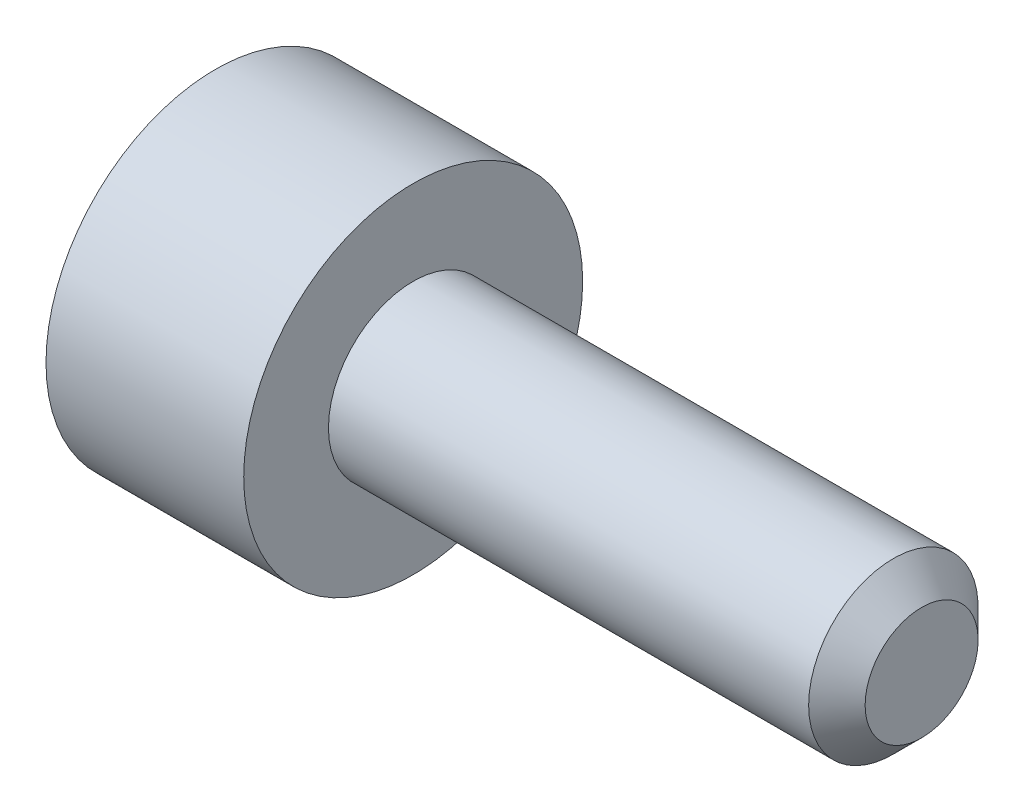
SolidWorks part; units mm, degrees
ref_plane "Face" through (0, 0, 0) normal (0, 0, 1) x (1, 0, 0)
ref_plane "Dessus" through (0, 0, 0) normal (0, 1, 0) x (1, 0, 0)
ref_plane "Droite" through (0, 0, 0) normal (1, 0, 0) x (0, 0, -1)
sketch "Esquisse1" plane through (0, 0, 0) normal (0, 0, 1) x (1, 0, 0)
  line L0 (0, 0) -> (0, 3)
  line L1 (0, 3) -> (3.5, 3)
  line L2 (3.5, 3) -> (3.5, 1.5)
  line L3 (3.5, 1.5) -> (12.5, 1.5)
  line L4 (12.5, 1.5) -> (12.5, 0)
  line L5 (-12.5636, 0) -> (62.4431, 0) construction
  line L6 (0, 0) -> (12.5, 0)
  dimension "D1" = 3
  dimension "D2" = 6
  dimension "D3" = 3.5
  dimension "D4" = 9
revolve "Révolution1" add sketch "Esquisse1" angle 360 about L5
sketch "Esquisse2" plane through (0, 0, 0) normal (-1, 0, 0) x (0, 0, 1)
  line L1 (1.1547, 2) -> (-1.1547, 2)
  line L2 (-1.1547, 2) -> (-2.3094, 0)
  line L3 (-2.3094, 0) -> (-1.1547, -2)
  line L4 (-1.1547, -2) -> (1.1547, -2)
  line L5 (1.1547, -2) -> (2.3094, 0)
  line L6 (2.3094, 0) -> (1.1547, 2)
  circle A0 centre (0, 0) radius 2 construction
  dimension "D1" = 4
extrude "Enlèv. mat.-Extru.1" cut sketch "Esquisse2" against normal blind 3
chamfer "Chanfrein1" distance 0.5 angle 45
